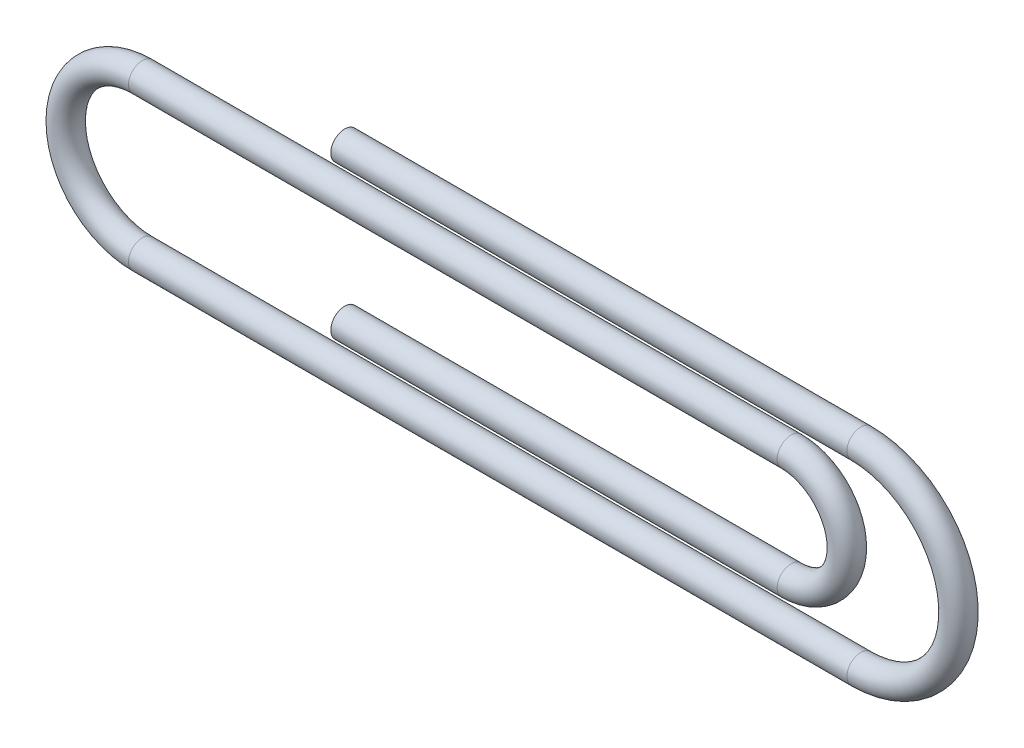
SolidWorks part; units mm, degrees
ref_plane "Front" through (0, 0, 0) normal (0, 0, 1) x (1, 0, 0)
ref_plane "Top" through (0, 0, 0) normal (0, 1, 0) x (1, 0, 0)
ref_plane "Right" through (0, 0, 0) normal (1, 0, 0) x (0, 0, -1)
sketch "Sketch1" plane through (0, 0, 0) normal (0, 0, 1) x (1, 0, 0)
  line L0 (0, 0) -> (18.5, 0)
  line L1 (18.5, -7) -> (-7.25, -7)
  line L2 (-7.25, -1.5) -> (16, -1.5)
  line L3 (16, -5.5) -> (0, -5.5)
  arc A0 (18.5, 0) -> (18.5, -7) centre (18.5, -3.5) cw
  arc A1 (-7.25, -7) -> (-7.25, -1.5) centre (-7.25, -4.25) cw
  arc A2 (16, -1.5) -> (16, -5.5) centre (16, -3.5) cw
  dimension "D3" = 4
  dimension "D5" = 32
  dimension "D6" = 3.5
  dimension "D1" = 1.5
  dimension "D2" = 1.5
  dimension "D4" = 10
sketch "Sketch2" plane through (0, 0, 0) normal (1, 0, 0) x (0, 0, -1)
  circle A0 centre (0, 0) radius 0.5
  dimension "D1" = 1
sweep "Sweep1" add profiles "Sketch2" path "Sketch1"
